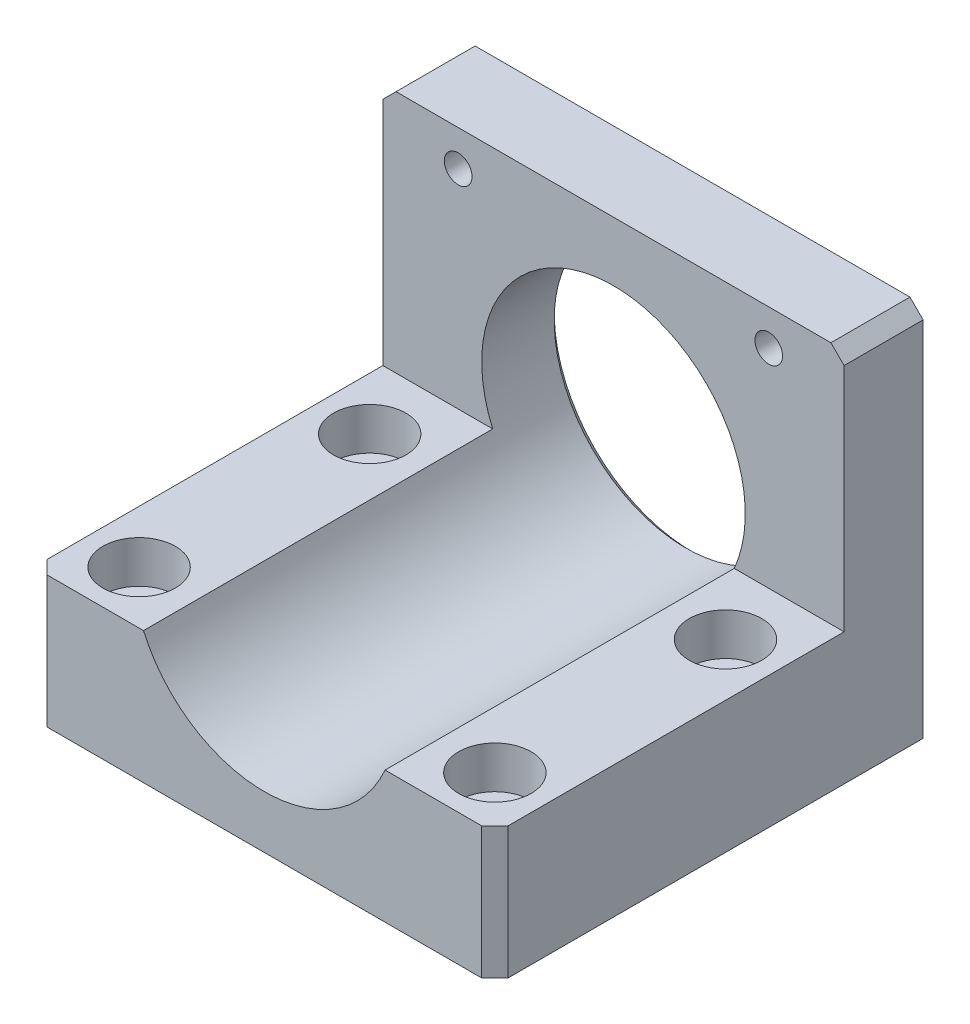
SolidWorks part; units mm, degrees
ref_plane "Plan1" through (0, 0, 0) normal (0, 0, 1) x (1, 0, 0)
ref_plane "Plan2" through (0, 0, 0) normal (0, 1, 0) x (1, 0, 0)
ref_plane "Plan3" through (0, 0, 0) normal (1, 0, 0) x (0, 0, -1)
sketch "Esquisse1" plane through (0, 0, 0) normal (0, 0, 1) x (1, 0, 0)
  line L0 (0, 36.7877) -> (0, -43.9143) construction
  line L1 (-35, 29) -> (35, 29)
  line L2 (-35, 29) -> (-35, -28)
  line L3 (-35, -28) -> (35, -28)
  line L4 (35, 29) -> (35, -28)
  line L5 (0, -50) -> (0, 50) construction
  line L7 (50, 0) -> (-50, 0) construction
  line L8 (-23.57, 23.57) -> (-23.57, -23.57) construction
  line L9 (-23.57, -23.57) -> (23.57, -23.57) construction
  line L10 (23.57, -23.57) -> (23.57, 23.57) construction
  line L11 (23.57, 23.57) -> (-23.57, 23.57) construction
  line L12 (-55.0838, 0) -> (73.4887, 0) construction
  circle A0 centre (0, 0) radius 20
  circle A1 centre (0, 0) radius 33.333 construction
  point P15 (23.57, 23.57)
  point P16 (-23.57, 23.57)
  point P17 (-23.57, -23.57)
  point P18 (23.57, -23.57)
  dimension "D1" = 40
  dimension "D4" = 66.666
  dimension "D3" = 47.14
  dimension "D5" = 57
  dimension "D6" = 70
  dimension "D7" = 29
  dimension "D8" = 28
extrude "Boss.-Extru.1" add sketch "Esquisse1" along normal blind 65
hole_wizard "Trou taraudé M51" positions "Esquisse2" profile "Esquisse3" tap size "M5" standard "ISO"
sketch "Esquisse2" plane through (0, 0, 0) normal (0, 0, -1) x (-1, 0, 0)
  point P0 (-23.57, 23.57)
  point P3 (23.57, 23.57)
  point P6 (23.57, -23.57)
  point P9 (-23.57, -23.57)
sketch "Esquisse3" plane through (23.57, 23.57, 0) normal (1, 0, 0) x (0, 1, 0)
  line L0 (0, 0) -> (0, 15.2618)
  line L1 (0, 15.2618) -> (2.1, 14)
  line L2 (2.1, 14) -> (2.1, 0)
  line L5 (2.1, 0) -> (0, 0)
  line L10 (0, 15.2618) -> (-2.1, 14) construction
  line L11 (0, -6.35) -> (0, 107.95) construction
  dimension "Diamètre du trou pour taraudage" = 4.2
  dimension "Profondeur du trou pour taraudage" = 14
  dimension "Angle de pointe" = 118
sketch "Esquisse4" plane through (0, 0, 0) normal (1, 0, 0) x (0, 0, -1)
  line L5 (-65, 29) -> (-65, -28) construction
  line L7 (-65, 29) -> (0, 29) construction
  line L8 (-12, 29) -> (-65, 29)
  line L9 (-12, 29) -> (-12, -8)
  line L10 (-12, -8) -> (-65, -8)
  line L11 (-65, 29) -> (-65, -8)
  line L12 (50, 0) -> (-50, 0) construction
  line L13 (0, 29) -> (0, -28) construction
  dimension "D1" = 8
  dimension "D2" = 12
extrude "Enlèv. mat.-Extru.1" cut sketch "Esquisse4" against normal through all both and the other way through all
hole_wizard "Chambrage pour vis à tête hexagonale M61" positions "Esquisse5" profile "Esquisse6" counterbore size "M6" standard "ISO"
sketch "Esquisse5" plane through (0, -8, 0) normal (0, 1, 0) x (1, 0, 0)
  line L0 (0, 12.5688) -> (0, -56.0157) construction
  line L2 (0, -50) -> (0, 50) construction
  line L4 (35, -65) -> (-35, -65) construction
  line L6 (-35, -12) -> (-18.3303, -12) construction
  point P0 (-27, -22)
  point P2 (-27, -57)
  point P13 (27, -57)
  point P14 (27, -22)
  dimension "D1" = 10
  dimension "D2" = 8
  dimension "D3" = 35
  dimension "D4" = 54
sketch "Esquisse6" plane through (-27, -8, 22) normal (1, 0, 0) x (0, 0, 1)
  line L0 (0, 0) -> (0, 20)
  line L1 (0, 20) -> (3.2, 20)
  line L3 (3.2, 20) -> (3.2, 6.4)
  line L4 (3.2, 6.4) -> (5.5, 6.4)
  line L5 (5.5, 6.4) -> (5.5, 0)
  line L7 (5.5, 0) -> (0, 0)
  line L11 (0, -6.35) -> (0, 107.95) construction
  dimension "Diamètre du perçage jusqu'au prochain" = 6.4
  dimension "Profondeur du perçage jusqu'au prochain" = 20
  dimension "Diamètre du chambrage" = 11
  dimension "Profondeur du chambrage" = 6.4
chamfer "Chanfrein2" distance 2 angle 45 6 edges at (35, -18, 65) (-35, -18, 65) (35, -28, 32.5) (-35, -28, 32.5) (-35, 29, 6) (35, 29, 6)
chamfer "Chanfrein3" distance 1 angle 45 1 edges at (20, 0, 0)
